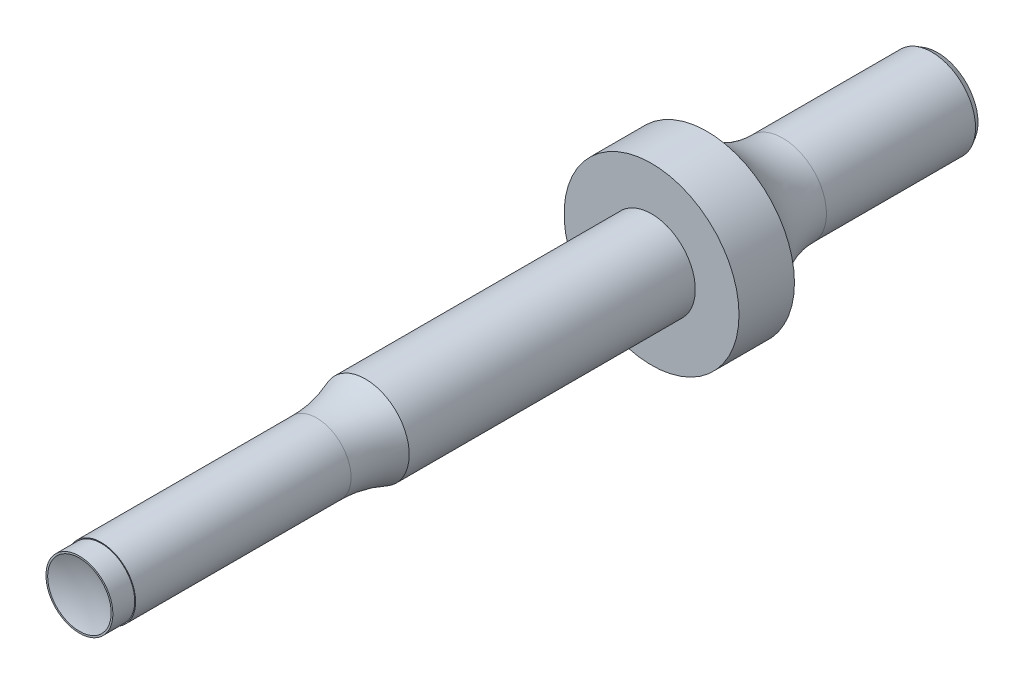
SolidWorks part; units mm, degrees
ref_plane "Front Plane" through (0, 0, 0) normal (0, 0, 1) x (1, 0, 0)
ref_plane "Top Plane" through (0, 0, 0) normal (0, 1, 0) x (1, 0, 0)
ref_plane "Right Plane" through (0, 0, 0) normal (1, 0, 0) x (0, 0, -1)
sketch "Sketch1" plane through (0, 0, 0) normal (0, 0, 1) x (1, 0, 0)
  circle A0 centre (0, 0) radius 5.095
  dimension "D1" = 10.19
extrude "Boss-Extrude1" add sketch "Sketch1" against normal blind 100
sketch "Sketch2" plane through (0, 0, 0) normal (0, 0, 1) x (1, 0, 0)
  circle A0 centre (0, 0) radius 4
  dimension "D1" = 8
extrude "Cut-Extrude1" cut sketch "Sketch2" against normal blind 33.3333 flip side to cut
sketch "Sketch3" plane through (0, 0, 0) normal (0, 0, 1) x (1, 0, 0)
  circle A0 centre (0, 0) radius 3.9
  dimension "D1" = 7.8
extrude "Cut-Extrude2" cut sketch "Sketch3" against normal blind 2.5475 flip side to cut
sketch "Sketch4" plane through (0, 0, 0) normal (1, 0, 0) x (0, 0, -1)
  line L0 (0, 0) -> (0, 3.7)
  line L1 (0, 3.9) -> (0, -3.9) construction
  line L2 (0.6955, 0) -> (0.6955, 3.7) construction
  line L3 (0, 0) -> (0.6955, 0)
  line L4 (0, 0) -> (0, -3.7) construction
  arc A0 (0.6955, 0) -> (0, 3.7) centre (-9.4945, 0) ccw
  dimension "D2" = 10.19
  dimension "D1" = 7.4
revolve "Cut-Revolve1" cut sketch "Sketch4" angle 360 about L3
chamfer "Chamfer1" distance 0.6793 angle 30 1 edges at (5.095, 0, -100)
sketch "Sketch5" plane through (0, 0, 0) normal (1, 0, 0) x (0, 0, -1)
  line L0 (33.3333, 0) -> (27.6522, 0)
  line L1 (33.3333, 5.095) -> (33.3333, -5.095) construction
  line L2 (27.6522, 0) -> (27.6522, 4)
  line L3 (33.3333, 4) -> (2.5475, 4) construction
  line L4 (33.3333, 5.095) -> (33.3333, 0)
  line L5 (27.6522, 4) -> (33.3333, 4) construction
  arc A0 (27.6522, 4) -> (33.3333, 5.095) centre (27.6522, 19.285) ccw
  dimension "D1" = 15.285
revolve "Revolve1" add sketch "Sketch5" angle 360 about L0
sketch "Sketch6" plane through (0, 0, 0) normal (1, 0, 0) x (0, 0, -1)
  line L0 (66.6667, 0) -> (81.9517, 0)
  line L1 (66.6667, 0) -> (66.6667, 10.19)
  line L2 (66.6667, 10.19) -> (73.1269, 10.19)
  line L3 (81.9517, 0) -> (81.9517, 5.095)
  line L4 (99.3207, 5.095) -> (33.3333, 5.095) construction
  line L5 (81.9517, 5.095) -> (66.6667, 5.095) construction
  line L6 (100, -5.095) -> (100, 5.095) construction
  arc A0 (81.9517, 5.095) -> (73.1269, 10.19) centre (81.9517, 15.285) cw
  dimension "D2" = 10.19
  dimension "D1" = 33.3333
  dimension "D3" = 15.285
revolve "Revolve2" add sketch "Sketch6" angle 360 about L0
sketch "Sketch7" plane through (0, 0, -100) normal (0, 0, -1) x (-1, 0, 0)
  line L9 (-8.6234, 1.9603) -> (-4.7028, 1.9603)
  line L10 (-8.6234, 1.9603) -> (-8.6234, -1.9603)
  line L11 (-8.6234, -1.9603) -> (-4.7028, -1.9603)
  line L12 (-4.7028, 1.9603) -> (-4.7028, -1.9603)
  circle A5 centre (0, 0) radius 5.095 construction
  circle A6 centre (0, 0) radius 4.7028 construction
  point P8 (-4.7028, 0)
extrude "Cut-Extrude3" [suppressed] cut sketch "Sketch7" against normal through all
